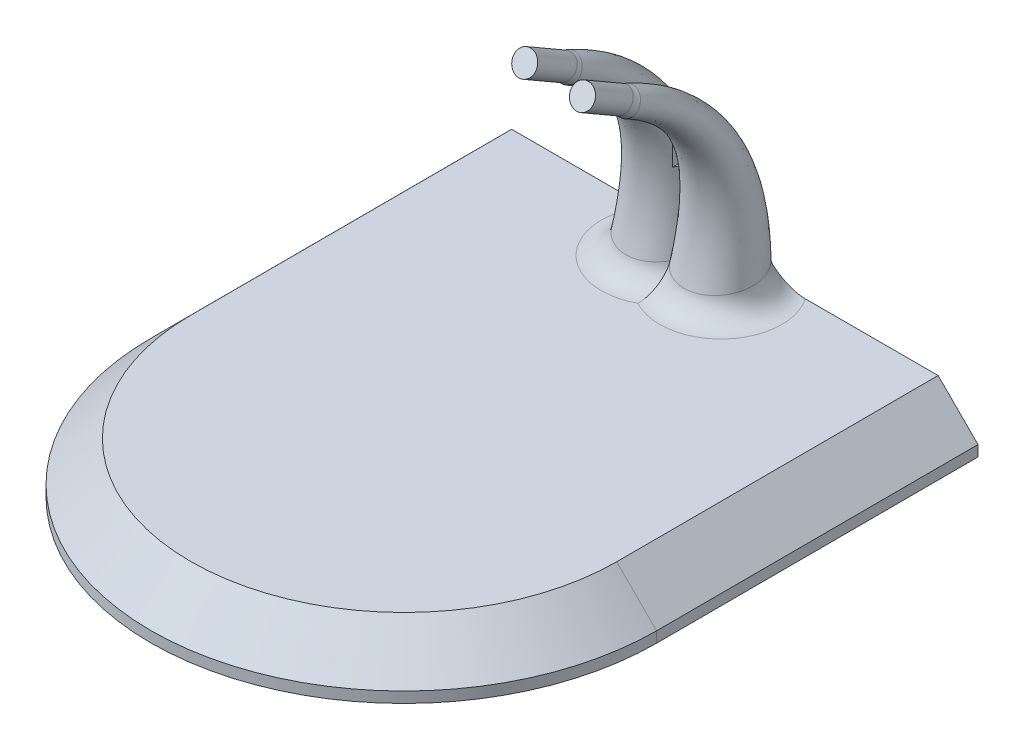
SolidWorks part; units mm, degrees
ref_plane "Front Plane" through (0, 0, 0) normal (0, 0, 1) x (1, 0, 0)
ref_plane "Top Plane" through (0, 0, 0) normal (0, 1, 0) x (1, 0, 0)
ref_plane "Right Plane" through (0, 0, 0) normal (1, 0, 0) x (0, 0, -1)
sketch "Sketch1" plane through (0, 0, 0) normal (0, 1, 0) x (1, 0, 0)
  line L0 (-0.1507, -1006.3304) -> (-0.1507, 48993.6696) construction
  line L1 (-63.6507, 55.3931) -> (63.3493, 55.3931) construction
  line L2 (-63.6507, 55.3931) -> (-63.6507, 80.7931) construction
  line L3 (-63.6507, 80.7931) -> (63.3493, 80.7931) construction
  line L4 (63.3493, 55.3931) -> (63.3493, 80.7931) construction
  line L5 (-1000, 0) -> (49000, 0) construction
  line L6 (-63.5, 0) -> (-63.6507, 80.7931)
  line L7 (-63.6507, 80.7931) -> (63.3493, 80.7931)
  line L8 (63.3493, 80.7931) -> (63.5, 0)
  circle A0 centre (0, 0) radius 63.5 construction
  arc A1 (63.5, 0) -> (-63.5, 0) centre (0, 0.1184) cw
  point P8 (-0.1507, 80.7931)
  dimension "D2" = 0
  dimension "D3" = 127
  dimension "D4" = 25.4
extrude "Boss-Extrude1" add sketch "Sketch1" along normal blind 12.7
chamfer "Chamfer1" distance 10 angle 45 3 edges at (63.4247, 12.7, -40.3966) (0, 12.7, 63.3817) (-63.5753, 12.7, -40.3966)
sketch "Sketch3" plane through (0, 12.7, 0) normal (0, 1, 0) x (1, 0, 0)
  line L0 (-0.0753, -967.9152) -> (-0.0753, 49032.0848) construction
  line L1 (-1031.8292, 80.7931) -> (48968.1708, 80.7931) construction
  line L3 (-53.5339, 18.1589) -> (53.4661, 18.1589) construction
  line L4 (-53.6507, 80.7931) -> (-53.5, 0.0187) construction
  line L5 (53.5, 0.0008) -> (53.3493, 80.7931) construction
  circle A0 centre (-7.3143, 71.2681) radius 9.525
  dimension "D1" = 19.05
  dimension "D2" = 7.239
  dimension "D3" = 9.525
ref_plane "Plane2" through (0, -4.688, -8.1199) normal (0, 0.5, 0.866) x (1, 0, 0)
sketch "Sketch4" plane through (0, -4.688, -8.1199) normal (0, 0.5, 0.866) x (1, 0, 0)
  line L0 (-0.0753, -945.3989) -> (-0.0753, 49054.6011) construction
  circle A0 centre (-7.3143, 80.9548) radius 3.175
  dimension "D1" = 6.35
  dimension "D2" = 7.239
ref_plane "Plane3" through (-7.239, 0, 0) normal (1, 0, 0) x (0, 0, -1)
sketch "Sketch6" plane through (-7.239, 0, 0) normal (1, 0, 0) x (0, 0, -1)
  spline S0 degree 2 poles (80.7928, 12.7) (84.4351, 51.7747) (50.1844, 68.1697) knots 0 0 0 1 1 1
  point P2 (0, 0)
  point P7 (0, 0)
loft "Loft3" add profiles "Sketch3", "Sketch4"
mirror "Mirror1" about plane through (0, 0, 0) normal (1, 0, 0) of "Loft3"
fillet "Fillet1" radius 6.35 1 edges at (-15.8704, 12.7, -67.0807)
fillet "Fillet2" radius 6.35 1 edges
sketch "Sketch9" plane through (0, -4.688, -8.1199) normal (0, 0.5, 0.866) x (1, 0, 0)
  line L0 (-7.239, -37.5085) -> (-7.239, 37.5085) construction
  circle A0 centre (-7.239, 81.0842) radius 2.921
  dimension "D1" = 5.842
extrude "Boss-Extrude2" add sketch "Sketch9" along normal blind 12.7
mirror "Mirror2" about plane through (0, 0, 0) normal (1, 0, 0) of "Boss-Extrude2"
fillet "Fillet3" radius 6.35 1 edges at (-7.239, 63.0033, -47.2015)
fillet "Fillet4" radius 6.35 1 edges at (7.239, 63.0033, -47.2015)
sketch "Sketch10" plane through (0, 0, -80.7931) normal (0, 0, -1) x (-1, 0, 0)
  line L0 (0.0008, 12.7) -> (0, 36.1939) construction
  line L1 (1.0158, 49.4517) -> (-1.0162, 49.4517)
  line L2 (1.0158, 49.4517) -> (1.0158, 36.9083)
  line L3 (1.0158, 36.9083) -> (-1.0162, 36.9083)
  line L4 (-1.0162, 49.4517) -> (-1.0162, 36.9083)
  line L5 (1.0158, 49.4517) -> (-1.0162, 36.9083) construction
  line L6 (1.0158, 36.9083) -> (-1.0162, 49.4517) construction
  line L7 (-63.3493, 0) -> (63.6507, 0) construction
  point P0 (-0.0002, 43.18)
  point P9 (0.1507, 0)
  dimension "D1" = 2.032
  dimension "D2" = 12.5434
  dimension "D3" = 43.18
extrude "Cut-Extrude1" cut sketch "Sketch10" against normal blind 50.8
